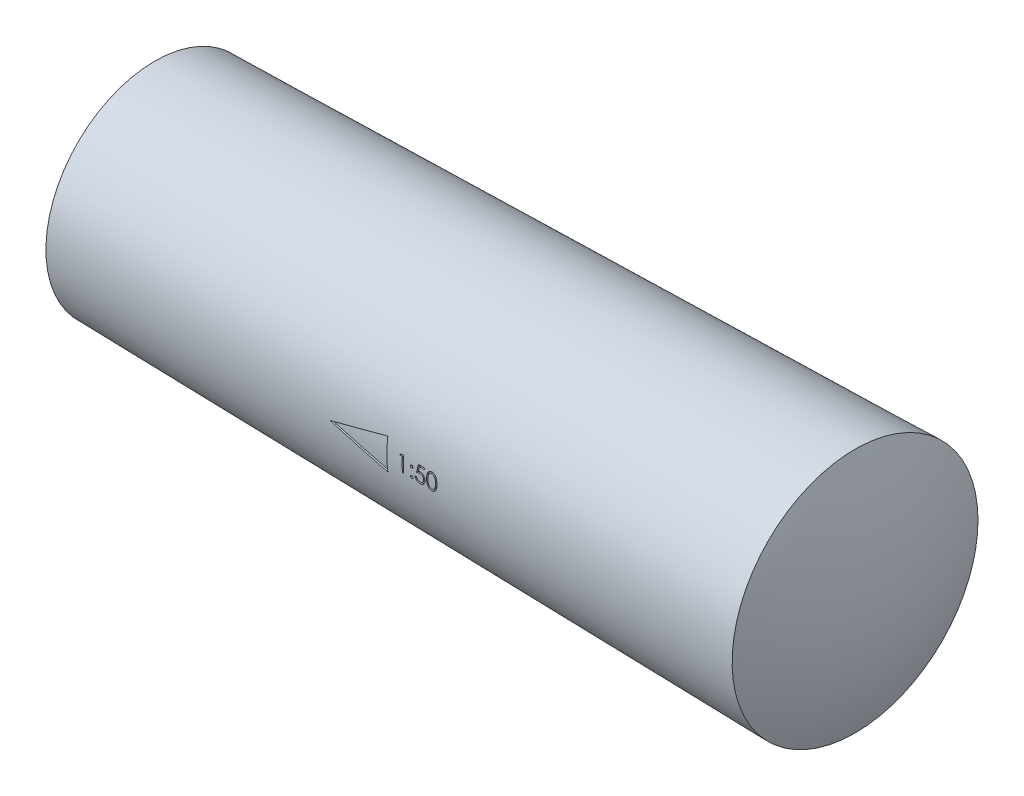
SolidWorks part; units mm, degrees
ref_plane "Front Plane" through (0, 0, 0) normal (0, 0, 1) x (1, 0, 0)
ref_plane "Top Plane" through (0, 0, 0) normal (0, 1, 0) x (1, 0, 0)
ref_plane "Right Plane" through (0, 0, 0) normal (1, 0, 0) x (0, 0, -1)
sketch "Sketch1" plane through (0, 0, 0) normal (1, 0, 0) x (0, 0, -1)
  circle A0 centre (0, 0) radius 7
  dimension "D1" = 14
extrude "Extrude1" add sketch "Sketch1" along normal mid plane 45
draft "Draft1" type of draft neutral plane draft angle 1.146 faces to draft 1 parameters "D1"=1.146
sketch "Sketch2" plane through (0, 0, 0) normal (0, 0, 1) x (1, 0, 0)
  line L0 (-22.5, 0) -> (-22.5, 7)
  line L1 (-22.5, 7) -> (-22.5, -7) construction
  line L2 (-22.5, 0) -> (-24.1, 0)
  line L3 (-24.1, 0) -> (-24.1, -7.45) construction
  line L4 (22.5, 0) -> (22.5, 7.9)
  line L5 (22.5, -7.9) -> (22.5, 7.9) construction
  line L6 (22.5, 0) -> (24.1, 0)
  line L7 (24.1, 0) -> (24.1, -7.45) construction
  line L8 (-22.5, -7) -> (22.5, -7.9) construction
  arc A0 (-24.1, 0) -> (-22.5, 7) centre (-7.9875, 0) cw
  arc A1 (24.1, 0) -> (22.5, 7.9) centre (3.7967, 0) ccw
  point P14 (0, -7.45)
revolve "Revolve1" add sketch "Sketch2" angle 360 about L2
sketch "Sketch5" plane through (0, 0, 0) normal (0, 0, 1) x (1, 0, 0)
  line L0 (0, 7.45) -> (0, -7.45) construction
  line L1 (22.5, 7.9) -> (-22.5, 7) construction
  line L2 (-22.5, -7) -> (22.5, -7.9) construction
ref_plane "Plane2" through (0, 0, 0) normal (-0.02, 0, 0.9998) x (0.9998, 0, 0.02)
sketch "Sketch6" plane through (0, 0, 0) normal (-0.02, 0, 0.9998) x (0.9998, 0, 0.02)
  line L0 (0, 0) -> (0, 1)
  line L1 (0, 7.45) -> (0, -7.45) construction
  line L2 (0, 1) -> (-3.7321, 0)
  line L3 (-3.7321, 0) -> (0, -1)
  line L4 (0, -1) -> (0, 0)
  line L5 (0, -0.5) -> (4, -0.5) construction
  text T0 "1:50" font "Century Gothic" height 1
  dimension "D1" = 2
  dimension "D2" = 30
  dimension "D3" = 4
wrap "Wrap2" sketch "Sketch6" wrap type deboss source sketch "Sketch6" thickness 0.1 parameters "D1"=0.1
equation "\"D2@Sketch2\" = \"D1@Sketch2\""
